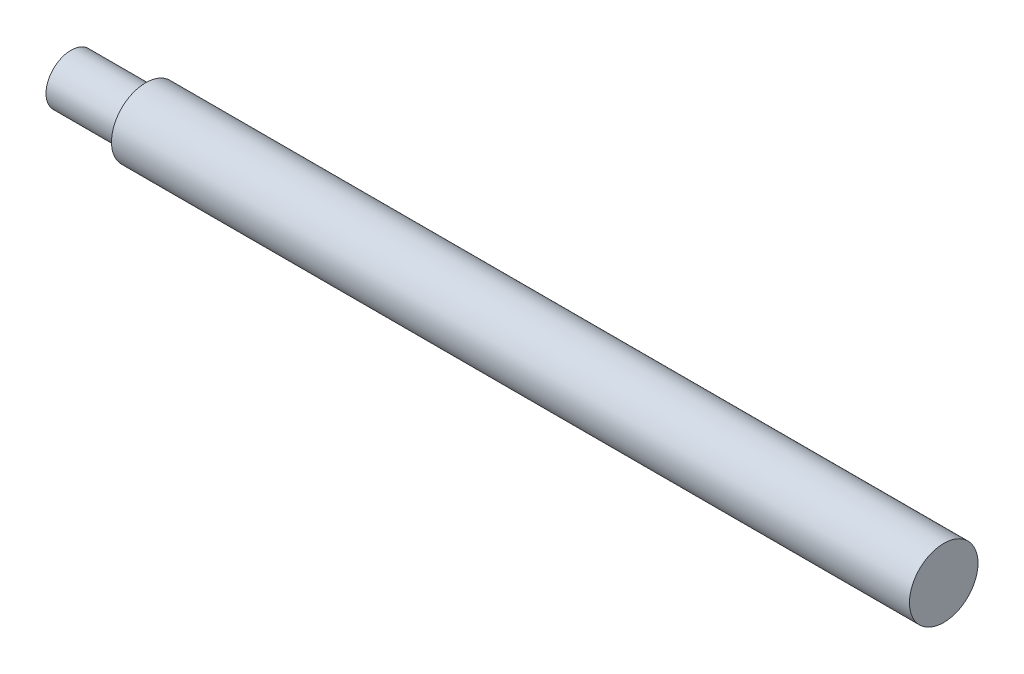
SolidWorks part; units mm, degrees
ref_plane "front" through (0, 0, 0) normal (0, 0, 1) x (1, 0, 0)
ref_plane "top" through (0, 0, 0) normal (0, 1, 0) x (1, 0, 0)
ref_plane "side" through (0, 0, 0) normal (1, 0, 0) x (0, 0, -1)
sketch "Sketch1"
  dimension "D1" = 34.925
extrude "Base-Extrude" add sketch "Sketch1" against normal blind 406.4
sketch "Sketch2"
  dimension "D1" = 25.4
extrude "Boss-Extrude1" add sketch "Sketch2" along normal blind 38.1
